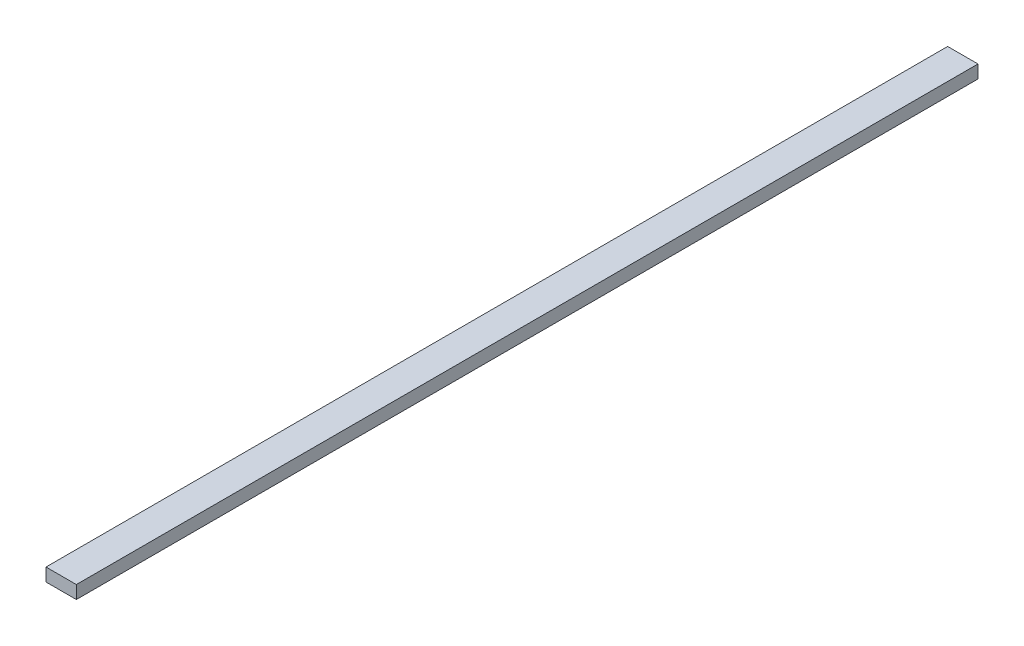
SolidWorks part; units mm, degrees
ref_plane "Front Plane" through (0, 0, 0) normal (0, 0, 1) x (1, 0, 0)
ref_plane "Top Plane" through (0, 0, 0) normal (0, 1, 0) x (1, 0, 0)
ref_plane "Right Plane" through (0, 0, 0) normal (1, 0, 0) x (0, 0, -1)
sketch "Sketch1" plane through (0, 0, 0) normal (0, 0, 1) x (1, 0, 0)
  line L0 (0, 19.05) -> (0, -19.05) construction
  line L1 (-44.45, 19.05) -> (44.45, 19.05)
  line L2 (-44.45, 19.05) -> (-44.45, -19.05)
  line L3 (-44.45, -19.05) -> (44.45, -19.05)
  line L4 (44.45, 19.05) -> (44.45, -19.05)
  dimension "D1" = 38.1
extrude "Boss-Extrude1" add sketch "Sketch1" along normal mid plane 2641.6
